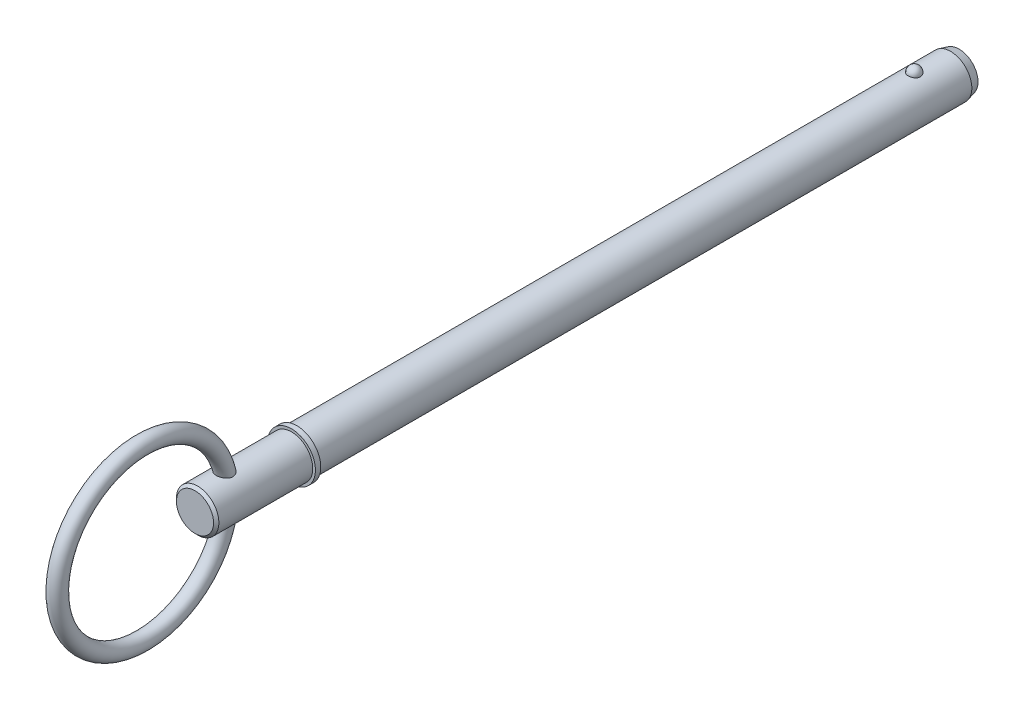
SolidWorks part; units mm, degrees
ref_plane "Front Plane" through (0, 0, 0) normal (0, 0, 1) x (1, 0, 0)
ref_plane "Top Plane" through (0, 0, 0) normal (0, 1, 0) x (1, 0, 0)
ref_plane "Right Plane" through (0, 0, 0) normal (1, 0, 0) x (0, 0, -1)
sketch "Sketch2" plane through (0, 0, 0) normal (0, 0, 1) x (1, 0, 0)
  circle A0 centre (0, 0) radius 3.97
  point P3 (0, 3.97)
  dimension "D1" = 7.94
extrude "Boss-Extrude1" add sketch "Sketch2" along normal blind 114.3
sketch "Sketch3" plane through (0, 0, 0) normal (0, 0, -1) x (-1, 0, 0)
  circle A0 centre (0, 0) radius 3.97
  dimension "D1" = 7.94
extrude "Boss-Extrude2" add sketch "Sketch3" along normal blind 9.53
chamfer "Chamfer1" distance 1.586 angle 15 1 edges at (-3.97, 0, -9.53)
sketch "Sketch18" plane through (0, 0, 0) normal (1, 0, 0) x (0, 0, -1)
  line L0 (7.944, 3.97) -> (-114.3, 3.97) construction
  line L1 (1.15, 5.12) -> (1.15, 2.82)
  line L2 (-114.3, -3.97) -> (7.944, -3.97) construction
  arc A0 (1.15, 5.12) -> (1.15, 2.82) centre (1.15, 3.97) ccw
  point P4 (0, 3.97)
  dimension "D1" = 9.09
revolve "Revolve1" add sketch "Sketch18" angle 360 about L1
sketch "Sketch19" plane through (0, 0, 0) normal (1, 0, 0) x (0, 0, -1)
  line L0 (-33.7288, 0) -> (-46.4542, 0) construction
sketch "Sketch20" plane through (0, 0, 0) normal (1, 0, 0) x (0, 0, -1)
  line L0 (-114.3, 0) -> (-114.3, 4.47)
  line L1 (-114.3, 3.97) -> (-114.3, -3.97) construction
  line L2 (-114.3, 4.47) -> (-115.3, 4.47)
  line L3 (-115.3, 4.47) -> (-115.3, 0)
  line L4 (-33.7288, 0) -> (-46.4542, 0) construction
  line L5 (-115.3, 0) -> (-114.3, 0)
  dimension "D1" = 4.47
  dimension "D2" = 1
revolve "Revolve2" add sketch "Sketch20" angle 360 about L0
sketch "Sketch21" plane through (0, 0, 114.3) normal (0, 0, -1) x (-1, 0, 0)
  circle A0 centre (0, 0) radius 3.97
  dimension "D1" = 7.94
extrude "Boss-Extrude3" add sketch "Sketch21" against normal blind 19.05
chamfer "Chamfer2" distance 0.5 angle 45 1 edges at (-3.97, 0, 133.35)
sketch "Sketch23" plane through (0, 0, 0) normal (1, 0, 0) x (0, 0, -1)
  line L0 (-133.35, 3.47) -> (-133.35, -3.47) construction
  circle A0 centre (-143.225, 0) radius 15.875
  point P2 (-127.35, 0)
  dimension "D1" = 31.75
  dimension "D2" = 6
sketch "Sketch24" plane through (0, 0, 0) normal (0, 1, 0) x (1, 0, 0)
  circle A0 centre (0, -127.35) radius 1.5
  dimension "D1" = 3
sweep "Sweep1" add profiles "Sketch24" path "Sketch23"
